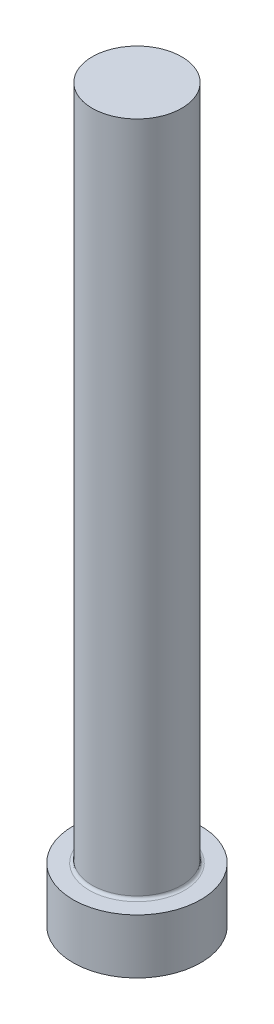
SolidWorks part; units mm, degrees
ref_plane "Front Plane" through (0, 0, 0) normal (0, 0, 1) x (1, 0, 0)
ref_plane "Top Plane" through (0, 0, 0) normal (0, 1, 0) x (1, 0, 0)
ref_plane "Right Plane" through (0, 0, 0) normal (1, 0, 0) x (0, 0, -1)
sketch "Sketch1" plane through (0, 0, 0) normal (0, 0, 1) x (1, 0, 0)
  line L0 (0, 0) -> (0, -1.906) construction
  line L1 (0, 0) -> (5.5499, 0)
  line L2 (5.5499, 0) -> (5.5499, 4.7498)
  line L3 (5.5499, 4.7498) -> (4.1402, 4.7498)
  line L4 (3.8862, 5.0038) -> (3.8862, 63.5)
  line L6 (0, 63.5) -> (3.8862, 63.5)
  line L7 (0, 63.5) -> (0, 0)
  arc A0 (4.1402, 4.7498) -> (3.8862, 5.0038) centre (4.1402, 5.0038) cw
  dimension "D5" = 0.254
  dimension "D" = 7.7724
  dimension "H" = 11.0998
  dimension "D4" = 63.5
  dimension "T" = 4.7498
revolve "Revolve3" add sketch "Sketch1" angle 360 about L0
